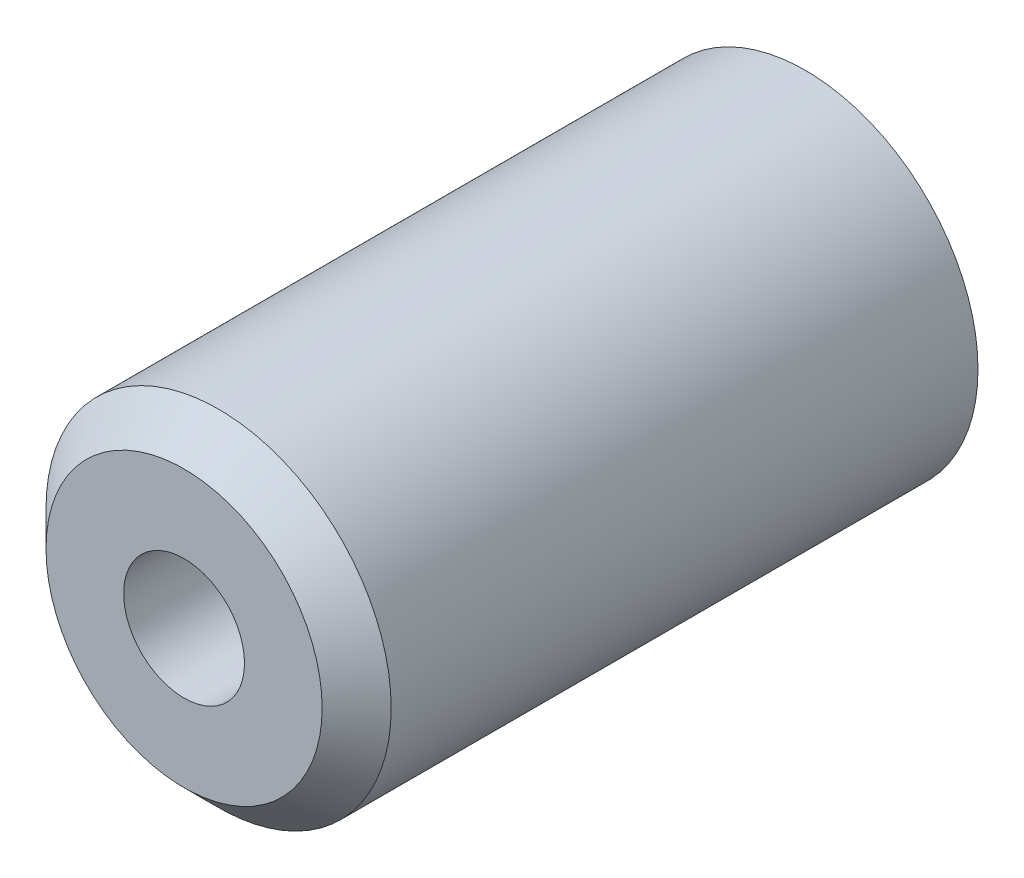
SolidWorks part; units mm, degrees
ref_plane "Front Plane" through (0, 0, 0) normal (0, 0, 1) x (1, 0, 0)
ref_plane "Top Plane" through (0, 0, 0) normal (0, 1, 0) x (1, 0, 0)
ref_plane "Right Plane" through (0, 0, 0) normal (1, 0, 0) x (0, 0, -1)
sketch "Sketch1" plane through (0, 0, 0) normal (0, 0, 1) x (1, 0, 0)
  circle A0 centre (0, 0) radius 1.75
  circle A1 centre (0, 0) radius 5
  dimension "D1" = 3.5
  dimension "D2" = 10
extrude "Extrude1" add sketch "Sketch1" along normal blind 18
chamfer "Chamfer1" distance 1 angle 45 1 edges at (5, 0, 18)
